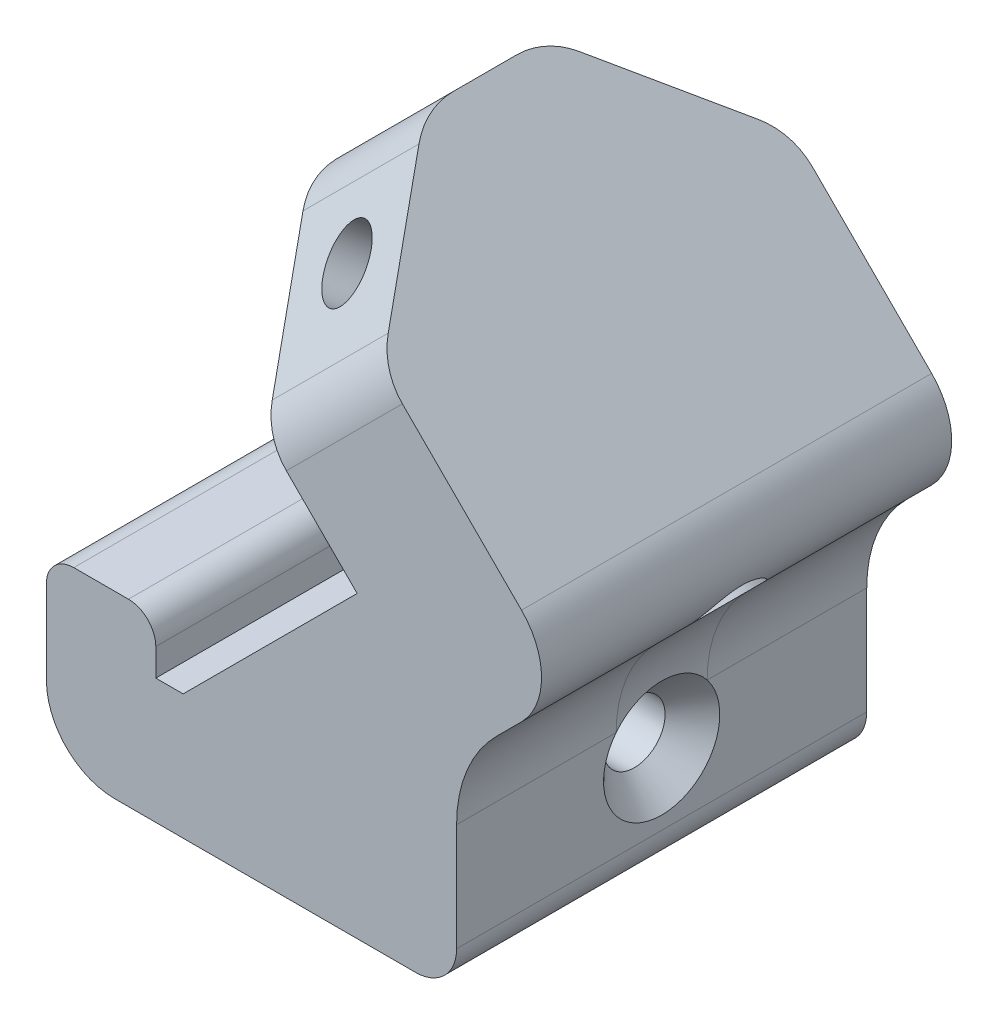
SolidWorks part; units mm, degrees
ref_plane "Plan de face" through (0, 0, 0) normal (0, 0, 1) x (1, 0, 0)
ref_plane "Plan de dessus" through (0, 0, 0) normal (0, 1, 0) x (1, 0, 0)
ref_plane "Plan de droite" through (0, 0, 0) normal (1, 0, 0) x (0, 0, -1)
sketch "Esquisse1" plane through (0, 0, 0) normal (0, 0, 1) x (1, 0, 0)
  line L0 (0, 0) -> (105.7981, 0) construction
  line L1 (0, 0) -> (78.3669, -78.3669) construction
  line L2 (0, 0) -> (-8.4853, -8.4853)
  line L3 (-8.4853, -8.4853) -> (5.6569, -22.6274)
  line L4 (5.6569, -22.6274) -> (-7.0711, -35.3553)
  line L5 (-7.0711, -35.3553) -> (-17.0711, -35.3553)
  line L6 (-17.0711, -35.3553) -> (-17.0711, -44.4975)
  line L7 (-17.0711, -44.4975) -> (12.9289, -44.4975)
  line L8 (12.9289, -44.4975) -> (12.9289, -29.4975)
  line L9 (12.9289, -29.4975) -> (21.2132, -21.2132)
  line L10 (21.2132, -21.2132) -> (0, 0)
  dimension "D1" = 45
  dimension "D2" = 18
  dimension "D3" = 12
  dimension "D4" = 20
  dimension "D5" = 30
  dimension "D6" = 15
  dimension "D7" = 10
  dimension "D8" = 30
extrude "Boss.-Extru.1" add sketch "Esquisse1" along normal blind 30
sketch "Esquisse2" plane through (0, -44.4975, 0) normal (0, -1, 0) x (1, 0, 0)
  line L0 (-17.0711, 30) -> (-17.0711, 0) construction
  line L1 (-17.0711, 30) -> (12.9289, 30) construction
  circle A0 centre (-1.0711, 15) radius 3
  dimension "D1" = 6
  dimension "D2" = 16
  dimension "D3" = 15
extrude "Enlèv. mat.-Extru.5" cut sketch "Esquisse2" against normal blind 18
sketch "Esquisse4" plane through (12.9289, 0, 0) normal (1, 0, 0) x (0, 0, -1)
  line L0 (0, -44.4975) -> (0, -29.4975) construction
  circle A0 centre (-15, -36.2828) radius 2.25
  dimension "D1" = 4.5
  dimension "D2" = 15
extrude "Enlèv. mat.-Extru.8" cut sketch "Esquisse4" against normal blind 15
chamfer "Chanfrein2" distance 2 angle 45 1 edges at (12.9289, -36.2828, 12.75)
fillet "Congé1" radius 10 1 edges at (12.9289, -29.4975, 15)
fillet "Congé2" radius 3 1 edges at (12.9289, -44.4975, 15)
sketch "Esquisse5" plane through (0, 0, 0) normal (0.7071, 0.7071, 0) x (0, 0, -1)
  line L0 (0, 0) -> (-10.6066, 0)
  line L1 (-30, 0) -> (0, 0) construction
  line L2 (-10.6066, 0) -> (0, -10.6066)
  line L3 (0, -30) -> (0, 0) construction
  line L4 (0, -10.6066) -> (0, 0)
  line L5 (-30, 0) -> (-19.3934, 0)
  line L6 (-19.3934, 0) -> (-30, -10.6066)
  line L7 (-30, -30) -> (-30, 0) construction
  line L8 (-30, -10.6066) -> (-30, 0)
  dimension "D1" = 15
  dimension "D2" = 15
  dimension "D3" = 45
extrude "Enlèv. mat.-Extru.9" cut sketch "Esquisse5" against normal blind 15
sketch "Esquisse6" plane through (-6.8566, 6.8566, 9.6967) normal (-0.5, 0.5, 0.7071) x (0.866, 0.2887, 0.4082)
  line L0 (16.5776, -23.4442) -> (7.9173, -11.1968) construction
  line L1 (-1.8806, -18.125) -> (7.9173, -11.1968) construction
  circle A0 centre (7.0598, -20.3764) radius 2.5
  dimension "D1" = 5
  dimension "D3" = 6
  dimension "D4" = 7
sketch "Esquisse9" plane through (3.75, -3.75, 5.3033) normal (-0.5, 0.5, -0.7071) x (-0.866, -0.2887, 0.4082)
  line L0 (4.3301, 6.1237) -> (-4.3301, -6.1237) construction
  line L1 (14.1281, -0.8045) -> (4.3301, 6.1237) construction
  circle A0 centre (5.1877, -3.0559) radius 2.5
  dimension "D1" = 5
  dimension "D2" = 6
  dimension "D3" = 7
extrude "Enlèv. mat.-Extru.15" cut sketch "Esquisse9" against normal blind 4
sketch "Esquisse10" plane through (5.75, -5.75, 8.1317) normal (-0.5, 0.5, -0.7071) x (-0.866, -0.2887, 0.4082)
  circle A0 centre (5.1877, -3.0559) radius 3
  circle A1 centre (5.1877, -3.0559) radius 2.5 construction
  dimension "D1" = 6
  dimension "D2" = 0
extrude "Enlèv. mat.-Extru.16" cut sketch "Esquisse10" against normal blind 12
sketch "Esquisse11" plane through (21.2132, -21.2132, 0) normal (0.7071, -0.7071, 0) x (0, 0, -1)
  line L0 (-30, 0) -> (0, 0) construction
  line L1 (-30, -7.5736) -> (-30, 0) construction
  circle A0 centre (-15, -6) radius 3
  dimension "D1" = 6
  dimension "D2" = 6
  dimension "D3" = 15
extrude "Enlèv. mat.-Extru.17" cut sketch "Esquisse11" against normal blind 18
extrude "Enlèv. mat.-Extru.18" cut sketch "Esquisse6" against normal blind 4
sketch "Esquisse12" plane through (-4.8566, 4.8566, 6.8683) normal (-0.5, 0.5, 0.7071) x (0.866, 0.2887, 0.4082)
  circle A0 centre (7.0598, -20.3764) radius 3
  dimension "D1" = 6
extrude "Enlèv. mat.-Extru.19" cut sketch "Esquisse12" against normal blind 12
sketch "Esquisse13" plane through (0, 0, 0) normal (0, 0, -1) x (-1, 0, 0)
  line L1 (17.0711, -35.3553) -> (9.0711, -35.3553)
  line L2 (17.0711, -35.3553) -> (17.0711, -31.3553)
  line L3 (17.0711, -31.3553) -> (9.0711, -31.3553)
  line L4 (9.0711, -35.3553) -> (9.0711, -31.3553)
  dimension "D1" = 8
  dimension "D2" = 4
extrude "Boss.-Extru.2" add sketch "Esquisse13" against normal blind 30
fillet "Congé3" radius 5 1 edges at (-17.0711, -44.4975, 15)
fillet "Congé4" radius 2 2 edges at (-17.0711, -31.3553, 15) (-9.0711, -31.3553, 15)
fillet "Congé5" radius 5 4 edges at (3.2574, -11.7426, 30) (-4.2426, -4.2426, 19.3934) (-4.2426, -4.2426, 10.6066) (3.2574, -11.7426, 0)
fillet "Congé6" radius 5 1 edges at (21.2132, -21.2132, 15)
